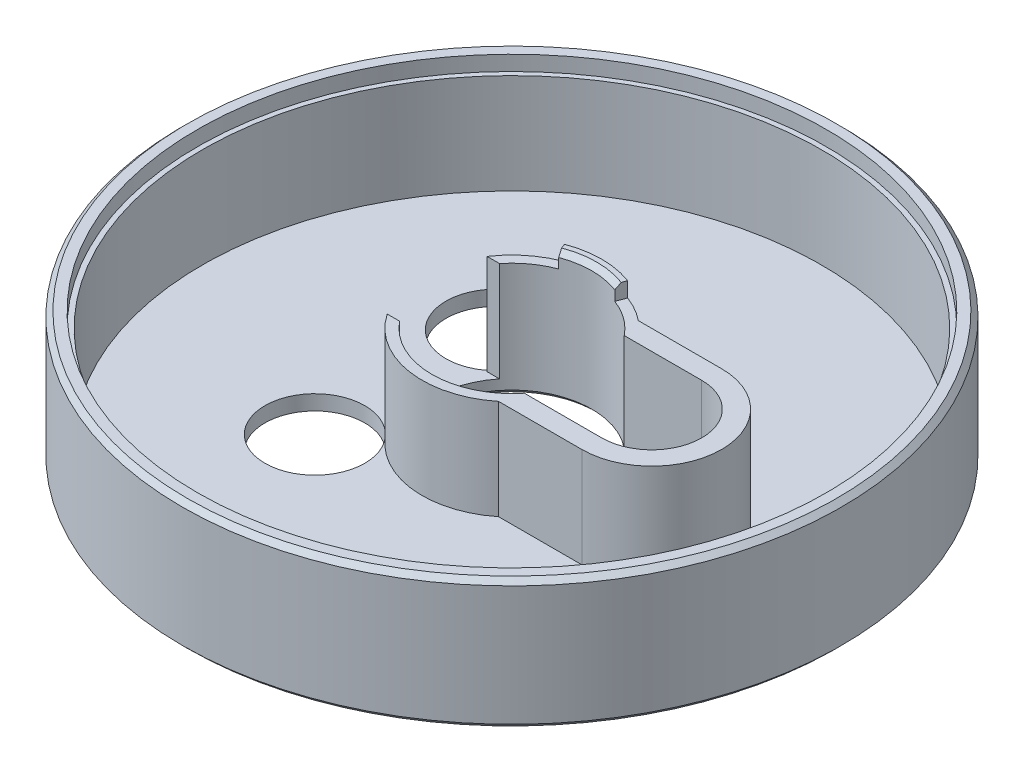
SolidWorks part; units mm, degrees
ref_plane "Front Plane" through (0, 0, 0) normal (0, 0, 1) x (1, 0, 0)
ref_plane "Top Plane" through (0, 0, 0) normal (0, 1, 0) x (1, 0, 0)
ref_plane "Right Plane" through (0, 0, 0) normal (1, 0, 0) x (0, 0, -1)
sketch "Sketch1" plane through (0, 0, 0) normal (0, 1, 0) x (1, 0, 0)
  circle A0 centre (0, 0) radius 8
  circle A1 centre (0, 0) radius 20 construction
  circle A2 centre (0, 0) radius 33
  circle A3 centre (0, 0) radius 14 construction
  circle A4 centre (0, 0) radius 26 construction
extrude "Boss-Extrude1" add sketch "Sketch1" against normal blind 13
sketch "Sketch2" plane through (0, 0, 0) normal (0, 1, 0) x (1, 0, 0)
  line L0 (0, 0) -> (0, 8) construction
  line L1 (0, 8) -> (3, 8) construction
  line L2 (3, 8) -> (2.809, 7.4906) construction
  line L3 (2.809, 7.4906) -> (3, 8)
  line L4 (3, 8) -> (3.1601, 8.427)
  line L5 (-2.809, 7.4906) -> (-3, 8)
  line L6 (-3, 8) -> (-3.1601, 8.427)
  arc A0 (-2.809, 7.4906) -> (2.809, 7.4906) centre (0, 0) ccw
  circle A1 centre (0, 0) radius 31.5
  arc A2 (3.1601, 8.427) -> (-3.1601, 8.427) centre (0, 0) ccw
extrude "Cut-Extrude1" cut sketch "Sketch2" against normal blind 1.5
chamfer "Chamfer1" distance 0.5 angle 45 4 edges at (0, 0, -8) (0, -13, 8) (0, -13, 33) (0, 0, 33)
sketch "Sketch3" plane through (0, -1.5, 0) normal (0, 1, 0) x (1, 0, 0)
  line L0 (14, 5) -> (-7.4833, 5)
  line L1 (14, -5) -> (-7.4833, -5)
  arc A0 (14, -5) -> (14, 5) centre (14, 0) ccw
  circle A1 centre (0, 0) radius 14 construction
  arc A2 (-7.4833, 5) -> (-7.4833, -5) centre (0, 0) ccw
extrude "Cut-Extrude2" cut sketch "Sketch3" against normal blind 10
sketch "Sketch4" plane through (0, -1.5, 0) normal (0, 1, 0) x (1, 0, 0)
  line L0 (14, 7) -> (5.6569, 7)
  line L1 (14, -7) -> (5.6569, -7)
  arc A0 (14, -7) -> (14, 7) centre (14, 0) ccw
  circle A1 centre (0, 0) radius 14 construction
  arc A2 (5.6569, 7) -> (5.6569, -7) centre (0, 0) ccw
  circle A3 centre (0, 0) radius 31
  circle A4 centre (0, 0) radius 26 construction
  circle A5 centre (-22.3137, 13.3453) radius 5 construction
extrude "Cut-Extrude3" cut sketch "Sketch4" against normal blind 10
sketch "Sketch5" plane through (0, -11.5, 0) normal (0, 1, 0) x (1, 0, 0)
  circle A0 centre (26, 0) radius 5
  circle A1 centre (0, 0) radius 26 construction
  circle A2 centre (-10.6693, 9.0646) radius 5
  circle A3 centre (0, 0) radius 14 construction
  circle A4 centre (-10.6693, -9.0646) radius 5
extrude "Cut-Extrude4" cut sketch "Sketch5" against normal through all
